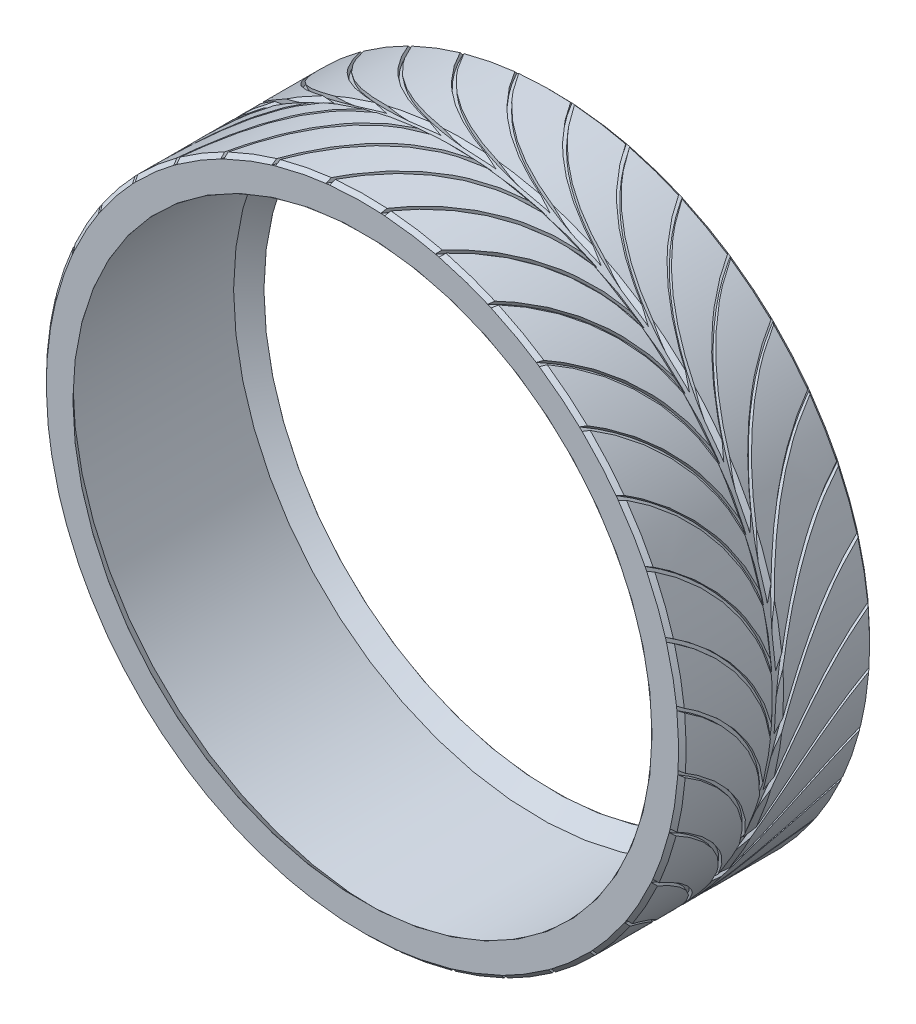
SolidWorks part; units mm, degrees
ref_plane "Plan de face" through (0, 0, 0) normal (0, 0, 1) x (1, 0, 0)
ref_plane "Plan de dessus" through (0, 0, 0) normal (0, 1, 0) x (1, 0, 0)
ref_plane "Plan de droite" through (0, 0, 0) normal (1, 0, 0) x (0, 0, -1)
sketch "Esquisse1" plane through (0, 0, 0) normal (1, 0, 0) x (0, 0, -1)
  line L2 (-10.6, 40.2) -> (10.6, 40.2)
  line L5 (12.6, 38.2) -> (12.6, 42.2)
  line L7 (-12.6, 42.2) -> (-12.6, 38.2)
  line L8 (0, 0) -> (-4.7144, 0) construction
  line L14 (-12.6, 42.2) -> (12.6, 42.2)
  line L15 (-12.6, 38.2) -> (-10.6, 40.2)
  line L16 (10.6, 40.2) -> (12.6, 38.2)
  point P2 (0, 40.2)
  dimension "D1" = 2
  dimension "D2" = 4
  dimension "D3" = 2
  dimension "D4" = 40.2
  dimension "D5" = 25.2
revolve "Révolution1" add sketch "Esquisse1" angle 360 about L8
sketch "Esquisse2" plane through (0, 0, 0) normal (0, 1, 0) x (1, 0, 0)
  line L0 (5, 0) -> (-5, 0) construction
  line L1 (-5, 0) -> (-12.2746, 12.6) construction
  line L2 (42.2, 12.6) -> (-42.2, 12.6) construction
  line L3 (-12.2746, 12.6) -> (-2.2746, 12.6) construction
  line L5 (-2.2746, 12.6) -> (5, 0) construction
  line L6 (4.8557, 0.25) -> (-5.1443, 0.25) construction
  line L7 (4.8557, 0.25) -> (7.8648, 0.25)
  line L8 (-12.2746, 12.6) -> (-11.7746, 12.6)
  line L9 (4.8557, -0.25) -> (7.8648, -0.25)
  line L10 (-12.2746, -12.6) -> (-11.7746, -12.6)
  line L11 (38.2, 12.6) -> (-38.2, 12.6) construction
  arc A0 (4.8557, 0.25) -> (-12.2746, 12.6) centre (10.0238, 25.474) cw
  arc A1 (-11.7746, 12.6) -> (7.8648, 0.25) centre (10.0238, 25.474) ccw
  arc A2 (4.8557, -0.25) -> (-12.2746, -12.6) centre (10.0238, -25.474) ccw
  arc A3 (-11.7746, -12.6) -> (7.8648, -0.25) centre (10.0238, -25.474) cw
  point P3 (0, 0)
  dimension "D4" = 0.5
  dimension "D1" = 10
  dimension "D2" = 0.25
  dimension "D3" = 60
wrap "Enroulement1" sketch "Esquisse2" wrap type deboss source sketch "Esquisse2" thickness 0.5 parameters "D1"=0.5
pattern_circular "Répétition circulaire1" count 36 every 10 about axis through (0, 0, 12.6) along (0, 0, -1) of "Enroulement1"
sketch "Esquisse3" plane through (0, 0, 0) normal (1, 0, 0) x (0, 0, -1)
  line L0 (-12.1, 42.2) -> (-12.6, 42.2)
  line L5 (-1.25, 42.7) -> (1.25, 42.7)
  line L6 (-1.25, 42.7) -> (-0.25, 41.7)
  line L7 (-0.25, 41.7) -> (0.25, 41.7)
  line L8 (1.25, 42.7) -> (0.25, 41.7)
  line L9 (-7.0748, 42.2) -> (-12.6, 42.2) construction
  line L10 (-12.6, 42.2) -> (-12.6, 41.7)
  line L11 (-12.6, 42.0965) -> (-12.6, 41.0623) construction
  line L12 (-12.6, 41.7) -> (-12.1, 42.2)
  line L13 (12.1, 42.2) -> (12.6, 42.2)
  line L14 (12.6, 42.2) -> (7.0748, 42.2) construction
  line L15 (12.6, 42.2) -> (12.6, 41.7)
  line L16 (12.6, 41.0623) -> (12.6, 42.0965) construction
  line L17 (12.6, 41.7) -> (12.1, 42.2)
  point P5 (0, 41.7)
  dimension "D1" = 0.5
  dimension "D2" = 41.7
  dimension "D3" = 0.5
  dimension "D4" = 135
  dimension "D5" = 135
  dimension "D6" = 1
revolve "Enlèvement de matière-Révolution2" cut sketch "Esquisse3" angle 360 about axis through (0, 0, 0) along (0, 0, -1)
